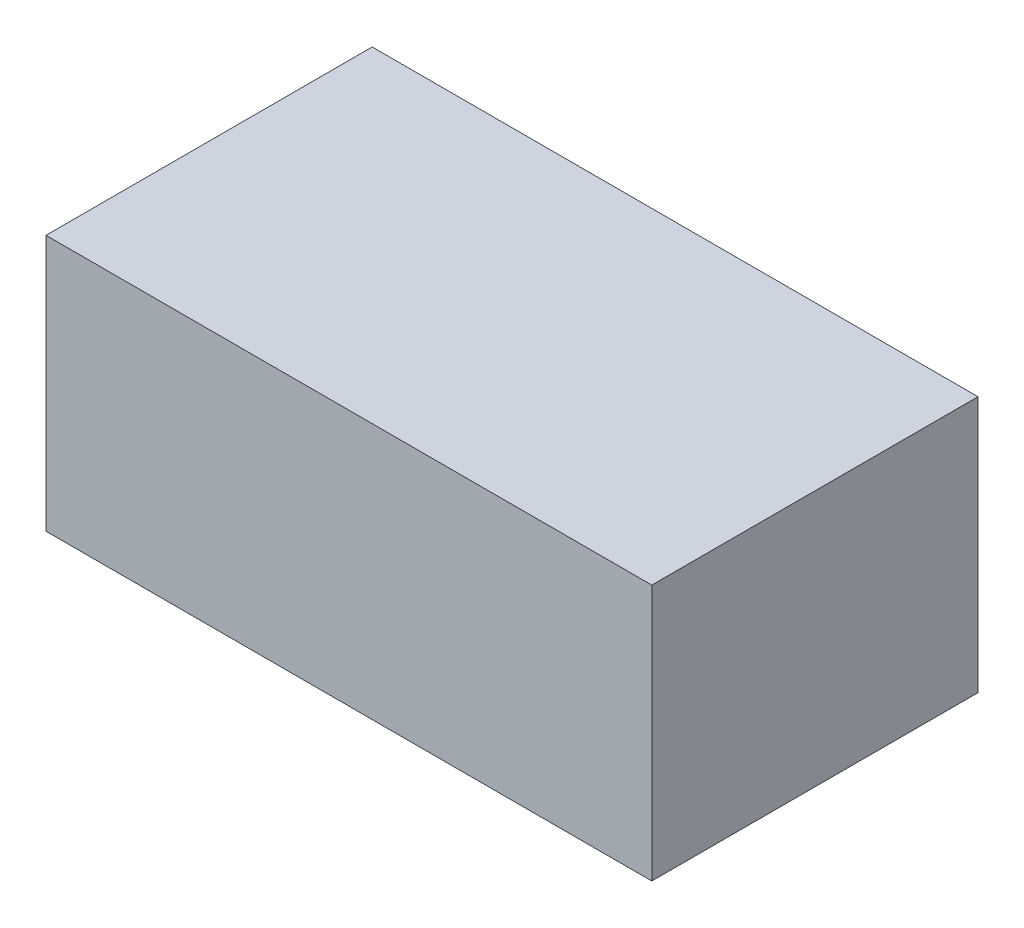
SolidWorks part; units mm, degrees
ref_plane "Front Plane" through (0, 0, 0) normal (0, 0, 1) x (1, 0, 0)
ref_plane "Top Plane" through (0, 0, 0) normal (0, 1, 0) x (1, 0, 0)
ref_plane "Right Plane" through (0, 0, 0) normal (1, 0, 0) x (0, 0, -1)
sketch "Sketch1" plane through (0, 0, 0) normal (0, 1, 0) x (1, 0, 0)
  line L1 (-13, 7) -> (13, 7)
  line L2 (-13, 7) -> (-13, -7)
  line L3 (-13, -7) -> (13, -7)
  line L4 (13, 7) -> (13, -7)
  line L5 (-13, 7) -> (13, -7) construction
  line L6 (-13, -7) -> (13, 7) construction
  point P0 (0, 0)
  dimension "D1" = 14
  dimension "D2" = 26
extrude "Boss-Extrude1" add sketch "Sketch1" along normal blind 11
